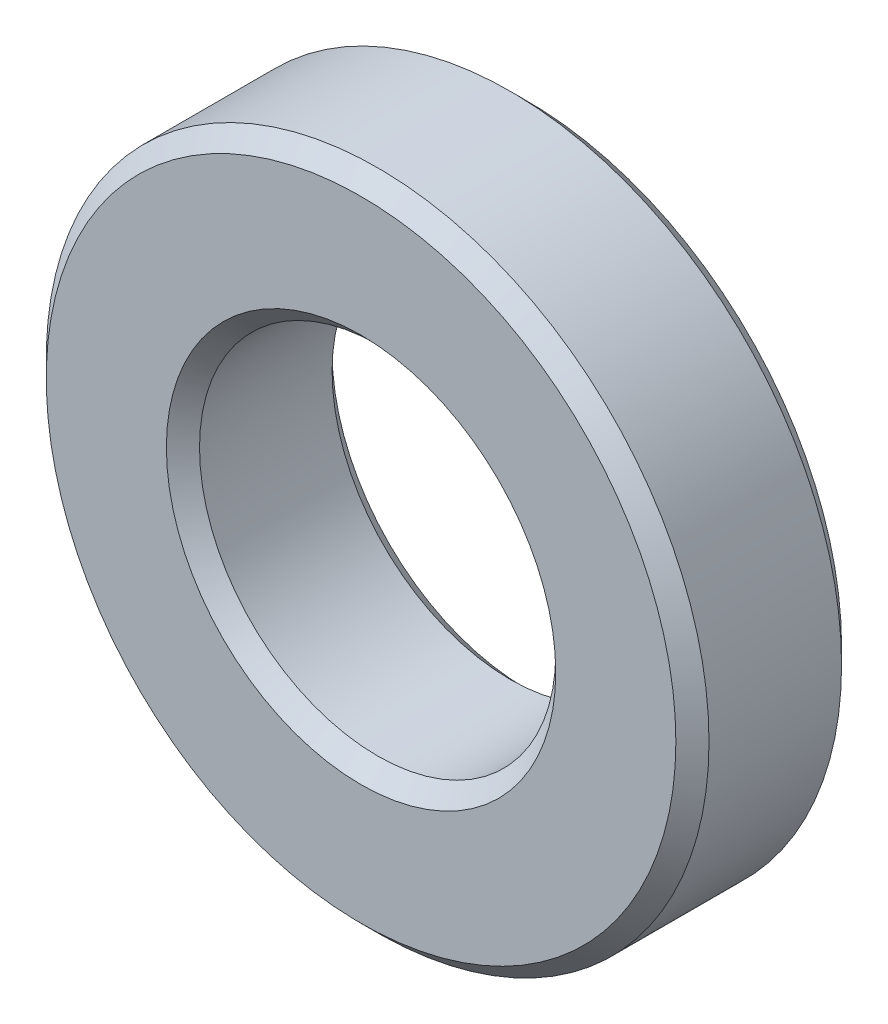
SolidWorks part; units mm, degrees
ref_plane "Front Plane" through (0, 0, 0) normal (0, 0, 1) x (1, 0, 0)
ref_plane "Top Plane" through (0, 0, 0) normal (0, 1, 0) x (1, 0, 0)
ref_plane "Right Plane" through (0, 0, 0) normal (1, 0, 0) x (0, 0, -1)
sketch "Sketch1" plane through (0, 0, 0) normal (0, 0, 1) x (1, 0, 0)
  circle A0 centre (0, 0) radius 4
  circle A1 centre (0, 0) radius 2.15
  dimension "D1" = 8
  dimension "D2" = 4.3
extrude "Boss-Extrude2" add sketch "Sketch1" along normal mid plane 2
chamfer "Chamfer3" distance 0.2 angle 45 4 edges at (4, 0, 1) (4, 0, -1) (2.15, 0, -1) (2.15, 0, 1)
